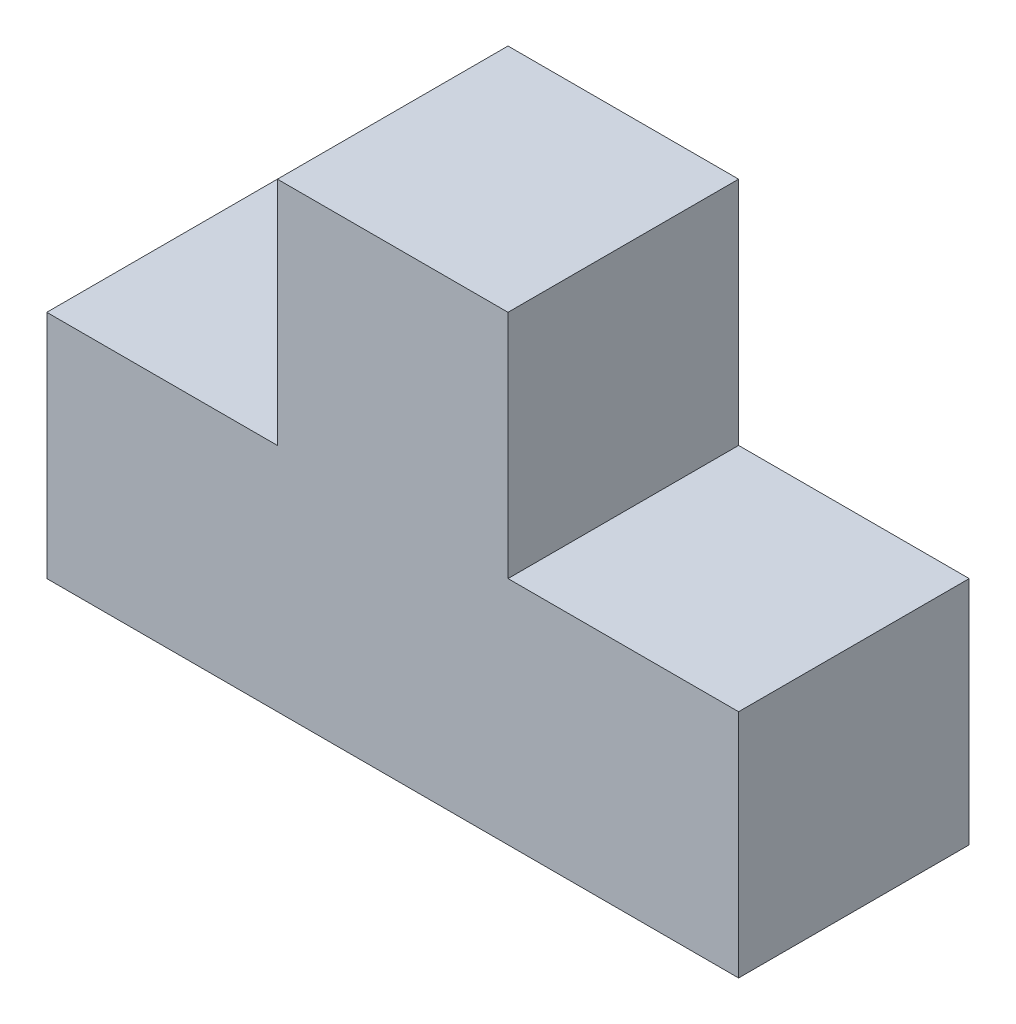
SolidWorks part; units mm, degrees
ref_plane "Front" through (0, 0, 0) normal (0, 0, 1) x (1, 0, 0)
ref_plane "Top" through (0, 0, 0) normal (0, 1, 0) x (1, 0, 0)
ref_plane "Right" through (0, 0, 0) normal (1, 0, 0) x (0, 0, -1)
sketch "Sketch1" plane through (0, 0, 0) normal (0, 0, 1) x (1, 0, 0)
  line L0 (0, 0) -> (0, 103.0713) construction
  line L1 (-25.4, 0) -> (25.4, 0)
  line L2 (-25.4, 0) -> (-25.4, 101.6)
  line L3 (-25.4, 101.6) -> (25.4, 101.6)
  line L4 (25.4, 0) -> (25.4, 101.6)
  line L5 (25.4, 0) -> (76.2, 0)
  line L6 (25.4, 0) -> (25.4, 50.8)
  line L7 (25.4, 50.8) -> (76.2, 50.8)
  line L8 (76.2, 0) -> (76.2, 50.8)
  line L9 (-76.2, 0) -> (-76.2, 50.8)
  line L10 (-25.4, 50.8) -> (-76.2, 50.8)
  line L11 (-25.4, 0) -> (-25.4, 50.8)
  line L12 (-25.4, 0) -> (-76.2, 0)
  dimension "D1" = 50.8
extrude "Extrude1" add sketch "Sketch1" along normal mid plane 50.8 contours L12 L2 L10 L9 | L1 L4 L3 L2 | L5 L8 L7 L4
